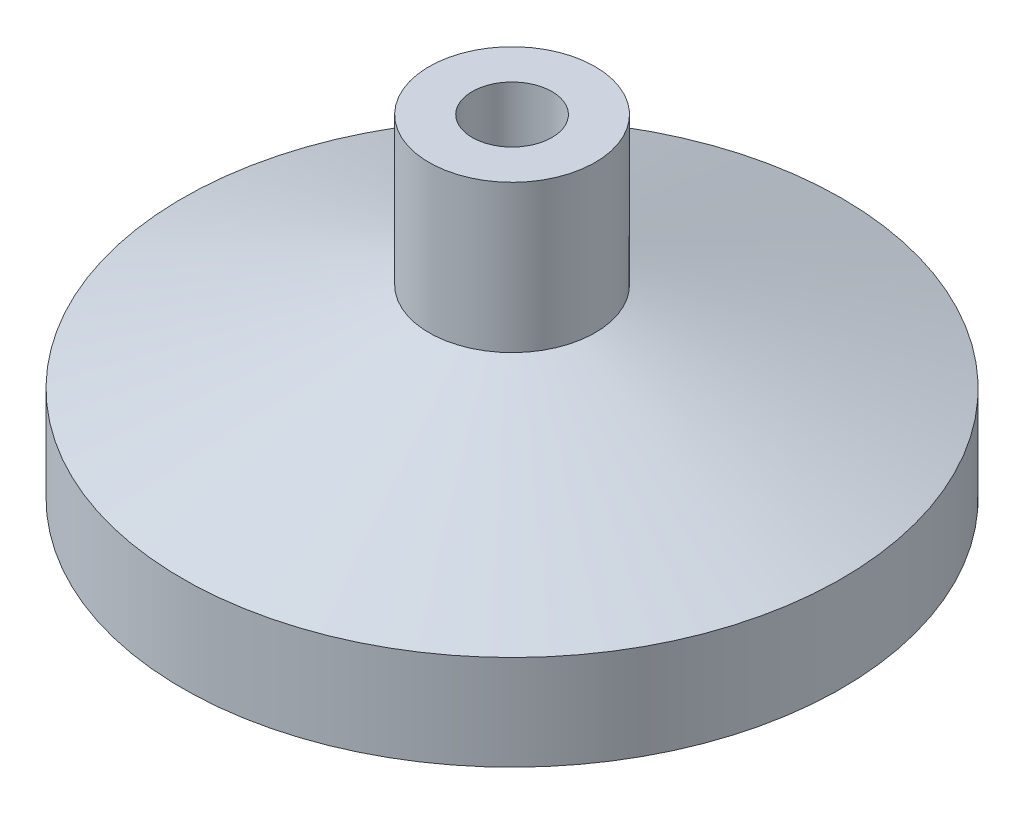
SolidWorks part; units mm, degrees
ref_plane "Front Plane" through (0, 0, 0) normal (0, 0, 1) x (1, 0, 0)
ref_plane "Top Plane" through (0, 0, 0) normal (0, 1, 0) x (1, 0, 0)
ref_plane "Right Plane" through (0, 0, 0) normal (1, 0, 0) x (0, 0, -1)
sketch "Sketch1" plane through (0, 0, 0) normal (0, 0, 1) x (1, 0, 0)
  line L0 (-1.524, 0.889) -> (-1.524, 12.7)
  line L1 (-1.524, 12.7) -> (-3.175, 12.7)
  line L2 (-3.175, 12.7) -> (-3.175, 7.062)
  line L3 (-3.175, 7.062) -> (-12.5984, 3.6322)
  line L4 (-12.5984, 3.6322) -> (-12.5984, 0)
  line L5 (-12.5984, 0) -> (-10.922, 0)
  line L6 (-10.922, 0) -> (-10.922, 1.3208)
  line L7 (0, 0) -> (0, 14.3564) construction
  line L9 (-8.6024, 0.889) -> (-1.524, 0.889)
  line L10 (-9.5843, 1.853) -> (-8.6024, 0.889)
  arc A2 (-9.5843, 1.853) -> (-10.922, 1.3208) centre (-10.1473, 1.3208) ccw
  dimension "D7" = 10.1473
  dimension "D1" = 12.7
  dimension "D2" = 3.6322
  dimension "D3" = 110
  dimension "D4" = 1.524
  dimension "D5" = 3.175
  dimension "D6" = 11.811
  dimension "D8" = 10.922
  dimension "D9" = 12.5984
  dimension "D10" = 8.6024
revolve "Revolve1" add sketch "Sketch1" angle 360 about L7
